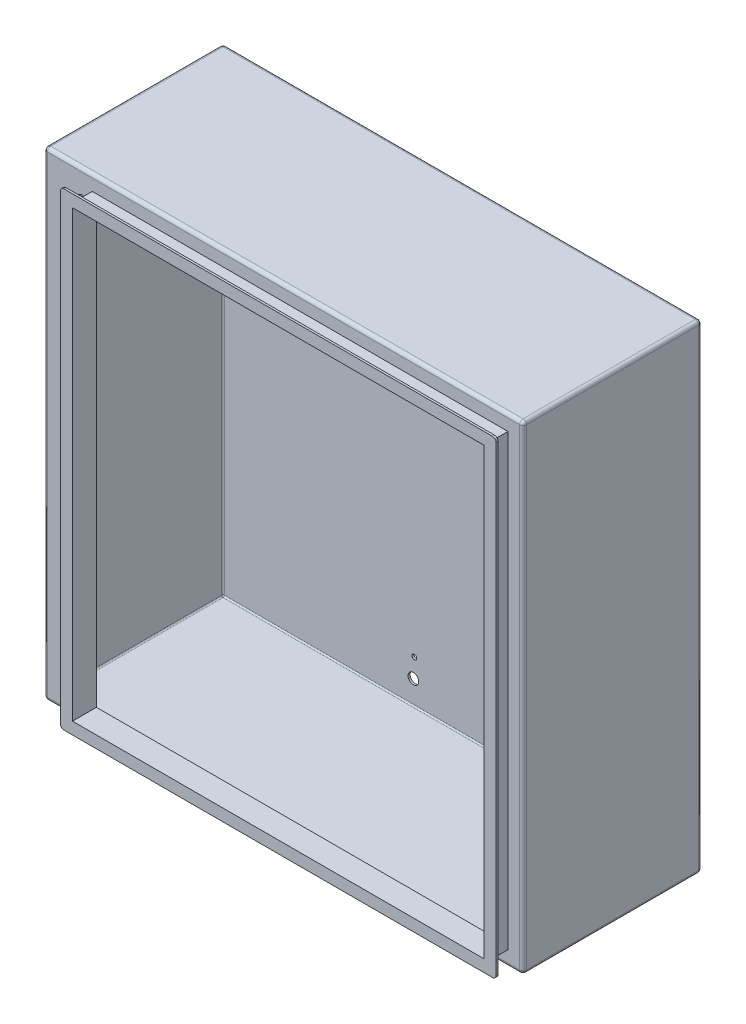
SolidWorks part; units mm, degrees
ref_plane "Front Plane" through (0, 0, 0) normal (0, 0, 1) x (1, 0, 0)
ref_plane "Top Plane" through (0, 0, 0) normal (0, 1, 0) x (1, 0, 0)
ref_plane "Right Plane" through (0, 0, 0) normal (1, 0, 0) x (0, 0, -1)
sketch "Model" plane through (0, 0, 0) normal (0, 0, 1) x (1, 0, 0)
  line L6 (-177.806, 177.7981) -> (-177.806, -177.8019)
  line L7 (-177.806, -177.8019) -> (177.794, -177.8019)
  line L8 (177.794, -177.8019) -> (177.794, 177.7981)
  line L9 (177.794, 177.7981) -> (-177.806, 177.7981)
  circle A20 centre (-34.931, 158.7544) radius 3.9624
  circle A21 centre (34.919, 158.7418) radius 3.9624
  circle A22 centre (34.919, -158.7582) radius 3.9624
  circle A23 centre (-34.931, -158.7582) radius 3.9624
  arc A24 (17.7719, 138.7849) -> (-17.7839, 138.7849) centre (-0.006, 139.0586) ccw
  arc A25 (-17.7839, 102.5023) -> (17.7719, 102.5023) centre (-0.006, 102.2286) ccw
  arc A26 (17.7719, 102.5023) -> (17.7719, 138.7849) centre (-0.006, 120.6436) ccw
  arc A27 (-17.7839, 138.7849) -> (-17.7839, 102.5023) centre (-0.006, 120.6436) ccw
  circle A28 centre (-34.169, 93.2296) radius 1.7526
  circle A29 centre (34.157, 93.2296) radius 1.7526
  circle A30 centre (-34.169, -144.5149) radius 1.7526
  circle A31 centre (34.157, -144.5149) radius 1.7526
sketch "Sketch63" plane through (0, 0, 0) normal (0, 0, 1) x (1, 0, 0)
  line L1 (-177.8, 177.8) -> (177.8, 177.8)
  line L2 (-177.8, 177.8) -> (-177.8, -177.8)
  line L3 (-177.8, -177.8) -> (177.8, -177.8)
  line L4 (177.8, 177.8) -> (177.8, -177.8)
  point P4 (0, 177.8)
  point P5 (-177.8, 0)
  dimension "D1" = 355.6
extrude "Boss-Extrude1" add sketch "Sketch63" along normal blind 132.842
sketch "Sketch64" plane through (0, 0, 132.842) normal (0, 0, 1) x (1, 0, 0)
  line L0 (-177.8, 177.8) -> (-177.8, -177.8) construction
  line L1 (-141.986, 166.624) -> (166.624, 166.624)
  line L2 (-141.986, 166.624) -> (-141.986, -166.624)
  line L3 (-141.986, -166.624) -> (166.624, -166.624)
  line L4 (166.624, 166.624) -> (166.624, -166.624)
  line L5 (177.8, 177.8) -> (-177.8, 177.8) construction
  line L6 (177.8, -177.8) -> (177.8, 177.8) construction
  line L7 (-177.8, -177.8) -> (177.8, -177.8) construction
  dimension "D1" = 35.814
  dimension "D2" = 11.176
  dimension "D3" = 11.176
  dimension "D4" = 11.176
extrude "Boss-Extrude2" add sketch "Sketch64" along normal blind 14.732
fillet "Fillet1" radius 2.54 12 edges at (0, -177.8, 132.842) (0, -177.8, 0) (-177.8, 0, 132.842) (-177.8, -177.8, 66.421) (-177.8, 0, 0) (0, 177.8, 132.842) (-177.8, 177.8, 66.421) (0, 177.8, 0) (177.8, -177.8, 66.421) (177.8, 0, 132.842) (177.8, 177.8, 66.421) (177.8, 0, 0)
shell "Shell1" thickness 1.524
sketch "Sketch65" plane through (0, 0, 147.574) normal (0, 0, 1) x (1, 0, 0)
  line L0 (165.1, -165.1) -> (165.1, 165.1) construction
  line L1 (-140.462, -165.1) -> (165.1, -165.1) construction
  line L2 (165.1, 165.1) -> (-140.462, 165.1) construction
  line L3 (-140.462, 165.1) -> (-140.462, -165.1) construction
  line L4 (165.1, -165.1) -> (165.1, 165.1)
  line L5 (-140.462, -165.1) -> (165.1, -165.1)
  line L6 (165.1, 165.1) -> (-140.462, 165.1)
  line L7 (-140.462, 165.1) -> (-140.462, -165.1)
  line L8 (-149.352, 173.99) -> (-149.352, -173.99)
  line L9 (-149.352, -173.99) -> (173.99, -173.99)
  line L10 (173.99, -173.99) -> (173.99, 173.99)
  line L11 (173.99, 173.99) -> (-149.352, 173.99)
extrude "Boss-Extrude3" add sketch "Sketch65" along normal blind 1.524
fillet "Fillet2" radius 2.54 4 edges at (173.99, -173.99, 148.336) (-149.352, -173.99, 148.336) (-149.352, 173.99, 148.336) (173.99, 173.99, 148.336)
sketch "Sketch66" plane through (0, 0, 0) normal (0, 0, -1) x (-1, 0, 0)
  circle A0 centre (34.169, -144.5149) radius 1.7526 construction
  circle A1 centre (34.931, -158.7582) radius 3.9624 construction
  circle A2 centre (-34.919, -158.7582) radius 3.9624 construction
  circle A3 centre (-34.157, -144.5149) radius 1.7526 construction
  arc A4 (-17.7719, 138.7849) -> (-17.7719, 102.5023) centre (0.006, 120.6436) ccw construction
  circle A5 centre (34.169, 93.2296) radius 1.7526 construction
  circle A6 centre (-34.157, 93.2296) radius 1.7526 construction
  arc A7 (-17.7719, 102.5023) -> (17.7839, 102.5023) centre (0.006, 102.2286) ccw construction
  arc A8 (17.7839, 102.5023) -> (17.7839, 138.7849) centre (0.006, 120.6436) ccw construction
  arc A9 (17.7839, 138.7849) -> (-17.7719, 138.7849) centre (0.006, 139.0586) ccw construction
  circle A10 centre (34.931, 158.7544) radius 3.9624 construction
  circle A11 centre (-34.919, 158.7418) radius 3.9624 construction
  circle A12 centre (34.169, -144.5149) radius 1.7526
  circle A13 centre (34.931, -158.7582) radius 3.9624
  circle A14 centre (-34.919, -158.7582) radius 3.9624
  circle A15 centre (-34.157, -144.5149) radius 1.7526
  arc A16 (-17.7719, 138.7849) -> (-17.7719, 102.5023) centre (0.006, 120.6436) ccw
  circle A17 centre (34.169, 93.2296) radius 1.7526
  circle A18 centre (-34.157, 93.2296) radius 1.7526
  arc A19 (-17.7719, 102.5023) -> (17.7839, 102.5023) centre (0.006, 102.2286) ccw
  arc A20 (17.7839, 102.5023) -> (17.7839, 138.7849) centre (0.006, 120.6436) ccw
  arc A21 (17.7839, 138.7849) -> (-17.7719, 138.7849) centre (0.006, 139.0586) ccw
  circle A22 centre (34.931, 158.7544) radius 3.9624
  circle A23 centre (-34.919, 158.7418) radius 3.9624
extrude "Cut-Extrude1" cut sketch "Sketch66" against normal up to next
hole_wizard "17/64 (0.26563) Diameter Hole1" positions "Sketch67" profile "Sketch68" hole size "17/64" standard "ANSI Inch"
sketch "Sketch67" plane through (0, 0, 132.842) normal (0, 0, 1) x (1, 0, 0)
  line L0 (-177.806, 177.7981) -> (-177.806, -177.8019) construction
  line L1 (177.794, 177.7981) -> (-177.806, 177.7981) construction
  line L2 (-177.806, -177.8019) -> (177.794, -177.8019) construction
  point P0 (-149.612, 157.2241)
  point P2 (-149.612, 115.3141)
  point P4 (-149.612, -115.3179)
  point P6 (-149.612, -157.2279)
  dimension "D1" = 28.194
  dimension "D2" = 20.574
  dimension "D3" = 62.484
  dimension "D4" = 20.574
  dimension "D5" = 62.484
sketch "Sketch68" plane through (-149.612, 157.2241, 132.842) normal (1, 0, 0) x (0, -1, 0)
  line L0 (0, 0) -> (0, 1.524)
  line L1 (0, 1.524) -> (3.3735, 1.524)
  line L2 (3.3735, 1.524) -> (3.3735, 0)
  line L5 (3.3735, 0) -> (0, 0)
  line L11 (0, -6.35) -> (0, 107.95) construction
  dimension "Thru Hole Dia." = 6.747
  dimension "Thru Hole Depth" = 1.524
